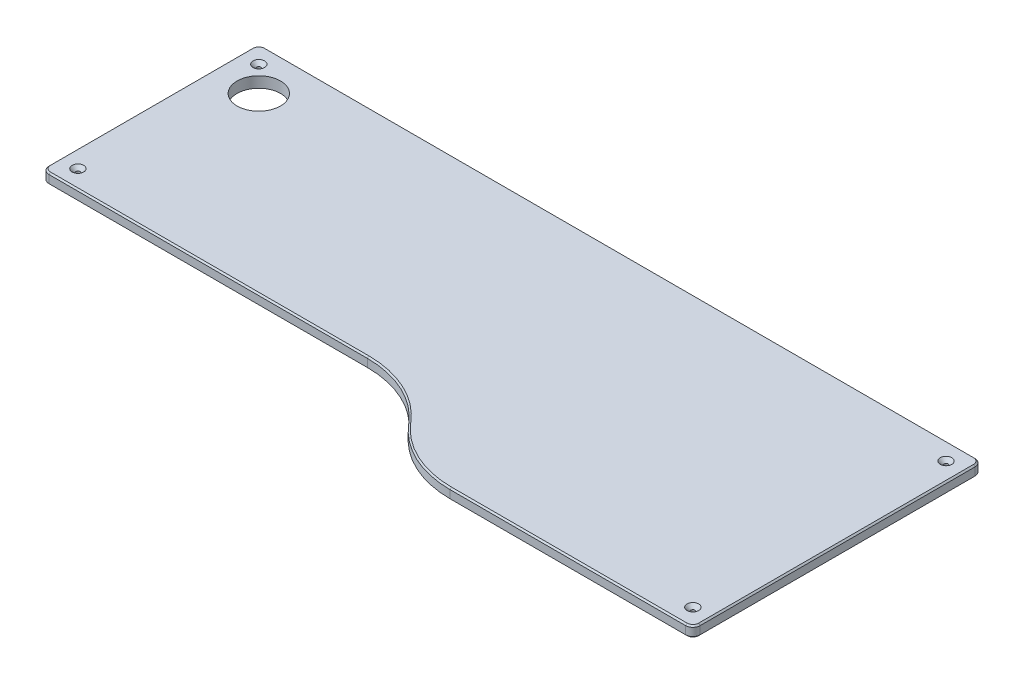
SolidWorks part; units mm, degrees
ref_plane "Front Plane" through (0, 0, 0) normal (0, 0, 1) x (1, 0, 0)
ref_plane "Top Plane" through (0, 0, 0) normal (0, 1, 0) x (1, 0, 0)
ref_plane "Right Plane" through (0, 0, 0) normal (1, 0, 0) x (0, 0, -1)
sketch "Sketch1" plane through (0, 0, 0) normal (0, 1, 0) x (1, 0, 0)
  line L0 (0, 125.4304) -> (0, 0) construction
  line L1 (-500, -200) -> (500, -200) construction
  line L2 (-500, -200) -> (-500, 200) construction
  line L3 (-490, 200) -> (490, 200)
  line L4 (500, -190) -> (500, 190)
  line L5 (-500, -200) -> (500, 200) construction
  line L6 (-500, 200) -> (500, -200) construction
  line L7 (0, 0) -> (188.5001, 0) construction
  line L8 (-490, -100) -> (-50, -100)
  line L9 (-500, -150) -> (57.2381, -150) construction
  line L10 (-475, -78) -> (-475, 175) construction
  line L11 (-475, 175) -> (475, 175) construction
  line L12 (475, 175) -> (475, -175) construction
  line L13 (-500, 190) -> (-500, -90)
  line L14 (164.4761, -200) -> (490, -200)
  circle A0 centre (-475, -75) radius 3
  circle A1 centre (-475, 175) radius 3
  circle A2 centre (475, 175) radius 3
  circle A3 centre (475, -175) radius 3
  arc A4 (-50, -100) -> (57.2381, -150) centre (-50, -240) cw
  arc A5 (57.2381, -150) -> (164.4761, -200) centre (164.4761, -60) ccw
  arc A6 (490, 200) -> (500, 190) centre (490, 190) cw
  arc A7 (490, -200) -> (500, -190) centre (490, -190) ccw
  arc A8 (-490, -100) -> (-500, -90) centre (-490, -90) cw
  arc A9 (-500, 190) -> (-490, 200) centre (-490, 190) cw
  point P0 (0, 0)
  point P33 (-500, -100)
  dimension "D5" = 6
  dimension "D8" = 140
  dimension "D9" = 450
  dimension "D11" = 6
  dimension "D12" = 6
  dimension "D14" = 6
  dimension "D15" = 10
  dimension "D1" = 1000
  dimension "D2" = 400
  dimension "D3" = 25
  dimension "D4" = 25
  dimension "D6" = 100
  dimension "D7" = 50
  dimension "D10" = 25
  dimension "D13" = 25
extrude "Boss-Extrude1" add sketch "Sketch1" along normal blind 15
chamfer "Chamfer1" distance 5 angle 45 4 edges at (475, 15, -172) (475, 15, 172) (-475, 15, 78) (-475, 15, -178)
sketch "Sketch2" plane through (0, 0, 0) normal (0, -1, 0) x (1, 0, 0)
  line L0 (475, 175) -> (475, -175) construction
  line L1 (475, -175) -> (472.5, -175) construction
  line L2 (472.5, -175) -> (472.5, 175) construction
  line L3 (472.5, 175) -> (475, 175) construction
  line L4 (0, -5) -> (642.4614, -5) construction
  line L5 (320.5, 175) -> (320.5, -5) construction
  line L6 (482.5, -5) -> (482.5, 163.6703) construction
  line L7 (158.5, -5) -> (158.5, 156.5689) construction
  line L8 (168.5, -175) -> (168.5, 175) construction
  line L10 (500, 190) -> (500, -190) construction
  circle A0 centre (168.5, 75) radius 2
  circle A1 centre (168.5, -75) radius 2
  circle A2 centre (472.5, -80) radius 2
  circle A3 centre (472.5, 70) radius 2
  dimension "D5" = 4
  dimension "D11" = 4
  dimension "D12" = 4
  dimension "D13" = 4
  dimension "D1" = 10
  dimension "D2" = 17.5
  dimension "D3" = 324
  dimension "D4" = 150
  dimension "D6" = 5
  dimension "D7" = 70
  dimension "D8" = 331.5
  dimension "D9" = 75
  dimension "D10" = 150
extrude "Cut-Extrude1" cut sketch "Sketch2" against normal blind 5
sketch "Sketch3" plane through (0, 15, 0) normal (0, 1, 0) x (1, 0, 0)
  line L0 (490, 200) -> (-490, 200) construction
  line L2 (-500, 190) -> (-500, -90) construction
  circle A0 centre (-440, 140) radius 30
  dimension "D1" = 60
  dimension "D2" = 60
  dimension "D3" = 60
extrude "Cut-Extrude2" cut sketch "Sketch3" against normal through all
chamfer "Chamfer2" distance 2 angle 45 22 edges at (-497.0711, 0, 97.0711) (-500, 0, -50) (-497.0711, 0, -197.0711) (0, 0, -200) (497.0711, 0, -197.0711) (500, 0, 0) (497.0711, 0, 197.0711) (-270, 0, 100) (327.2381, 0, 200) (105.3153, 0, 186.8858) (9.1608, 0, 113.1142) (497.0711, 15, 197.0711) (500, 15, 0) (497.0711, 15, -197.0711) (327.2381, 15, 200) (105.3153, 15, 186.8858) (9.1608, 15, 113.1142) (0, 15, -200) (-497.0711, 15, -197.0711) (-270, 15, 100) (-497.0711, 15, 97.0711) (-500, 15, -50)
